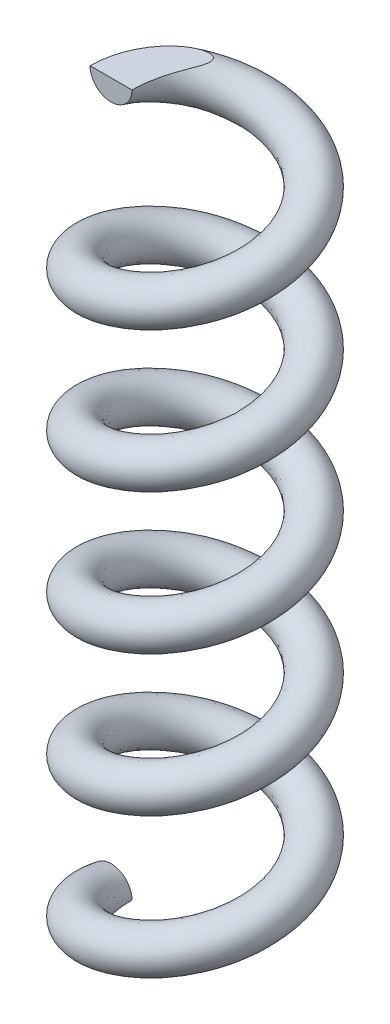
SolidWorks part; units mm, degrees
ref_plane "Front Plane" through (0, 0, 0) normal (0, 0, 1) x (1, 0, 0)
ref_plane "Top Plane" through (0, 0, 0) normal (0, 1, 0) x (1, 0, 0)
ref_plane "Right Plane" through (0, 0, 0) normal (1, 0, 0) x (0, 0, -1)
sketch "Sketch1" plane through (0, 0, 0) normal (0, 0, 1) x (1, 0, 0)
  line L1 (-24, -71.5) -> (-38, -71.5) construction
  circle A0 centre (-38, -71.5) radius 3.5
  dimension "D3" = 7
  dimension "D2" = 14
sketch "Sketch5" plane through (0, 0, 0) normal (0, 0, 1) x (1, 0, 0)
  line L0 (-24, -71.5) -> (-24, 45.4785)
  line L3 (-29, 45.4785) -> (-19, 45.4785) construction
  point P3 (0, 0)
  point P4 (0, 0)
  point P5 (0, 0)
  point P7 (0, 0)
sweep "Sweep3" add profiles "Sketch1" path "Sketch5" parameters "D4"=1800
ref_plane "Plane3" through (0, 45.4785, 0) normal (0, 1, 0) x (1, 0, 0)
ref_plane "Plane4" through (0, -71.5, 0) normal (0, 1, 0) x (1, 0, 0)
other "SurfaceCut1"
other "SurfaceCut2"
